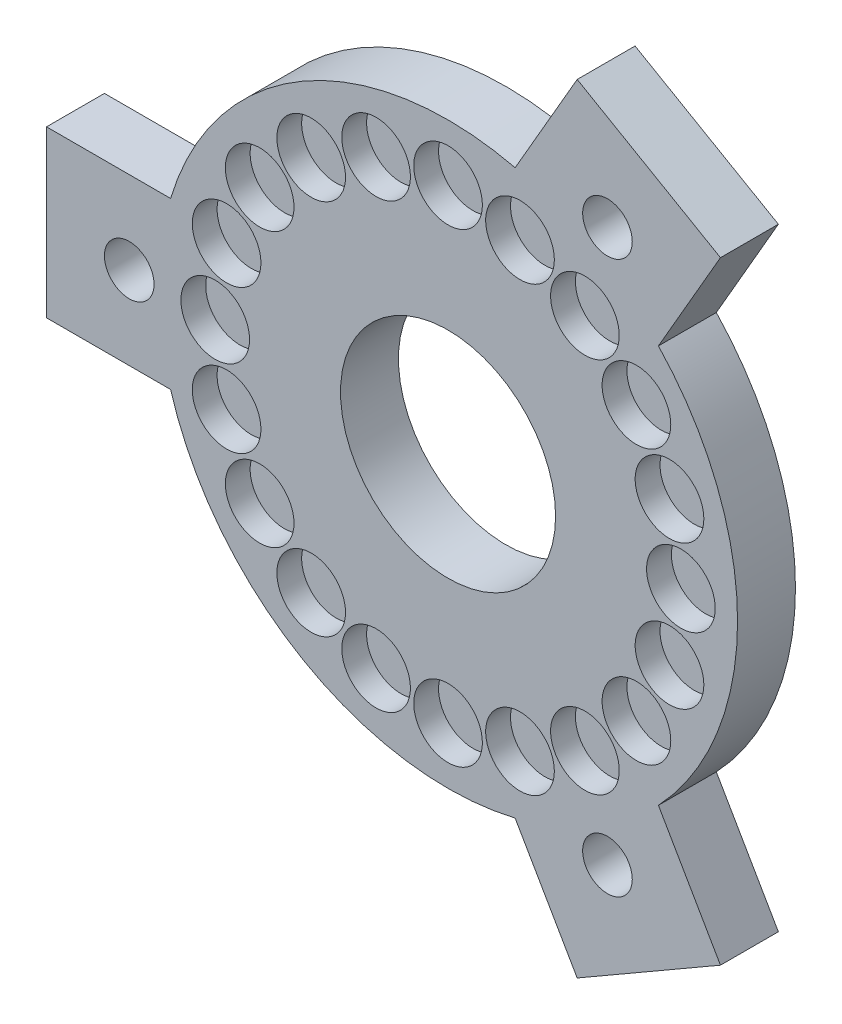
SolidWorks part; units mm, degrees
ref_plane "Ebene vorne" through (0, 0, 0) normal (0, 0, 1) x (1, 0, 0)
ref_plane "Ebene oben" through (0, 0, 0) normal (0, 1, 0) x (1, 0, 0)
ref_plane "Ebene rechts" through (0, 0, 0) normal (1, 0, 0) x (0, 0, -1)
sketch "Skizze1" plane through (0, 0, 0) normal (0, 0, 1) x (1, 0, 0)
  circle A0 centre (0, 0) radius 28.15
  circle A1 centre (0, 28.15) radius 4.3077
  circle A2 centre (8.6988, 26.7722) radius 4.3077
  circle A3 centre (16.5462, 22.7738) radius 4.3077
  circle A4 centre (22.7738, 16.5462) radius 4.3077
  circle A5 centre (26.7722, 8.6988) radius 4.3077
  circle A6 centre (28.15, 0) radius 4.3077
  circle A7 centre (26.7722, -8.6988) radius 4.3077
  circle A8 centre (22.7738, -16.5462) radius 4.3077
  circle A9 centre (16.5462, -22.7738) radius 4.3077
  circle A10 centre (8.6988, -26.7722) radius 4.3077
  circle A11 centre (0, -28.15) radius 4.3077
  circle A12 centre (-8.6988, -26.7722) radius 4.3077
  circle A13 centre (-16.5462, -22.7738) radius 4.3077
  circle A14 centre (-22.7738, -16.5462) radius 4.3077
  circle A15 centre (-26.7722, -8.6988) radius 4.3077
  circle A16 centre (-28.15, 0) radius 4.3077
  circle A17 centre (-26.7722, 8.6988) radius 4.3077
  circle A18 centre (-22.7738, 16.5462) radius 4.3077
  circle A19 centre (-16.5462, 22.7738) radius 4.3077
  circle A20 centre (-8.6988, 26.7722) radius 4.3077
  circle A21 centre (0, 0) radius 35
  point P46 (0, 0)
  dimension "D1" = 20
  dimension "D2" = 70
  dimension "D3" = 56.3
extrude "Aufsatz-Linear austragen3" add sketch "Skizze1" along normal blind 7 contours A21
sketch "Skizze3" plane through (0, 0, 7) normal (0, 0, 1) x (1, 0, 0)
  circle A0 centre (0, 0) radius 28.15
  circle A1 centre (0, 28.15) radius 4.15
  circle A2 centre (8.6988, 26.7722) radius 4.15
  circle A3 centre (16.5462, 22.7738) radius 4.15
  circle A4 centre (22.7738, 16.5462) radius 4.15
  circle A5 centre (26.7722, 8.6988) radius 4.15
  circle A6 centre (28.15, 0) radius 4.15
  circle A7 centre (26.7722, -8.6988) radius 4.15
  circle A8 centre (22.7738, -16.5462) radius 4.15
  circle A9 centre (16.5462, -22.7738) radius 4.15
  circle A10 centre (8.6988, -26.7722) radius 4.15
  circle A11 centre (0, -28.15) radius 4.15
  circle A12 centre (-8.6988, -26.7722) radius 4.15
  circle A13 centre (-16.5462, -22.7738) radius 4.15
  circle A14 centre (-22.7738, -16.5462) radius 4.15
  circle A15 centre (-26.7722, -8.6988) radius 4.15
  circle A16 centre (-28.15, 0) radius 4.15
  circle A17 centre (-26.7722, 8.6988) radius 4.15
  circle A18 centre (-22.7738, 16.5462) radius 4.15
  circle A19 centre (-16.5462, 22.7738) radius 4.15
  circle A20 centre (-8.6988, 26.7722) radius 4.15
  point P46 (0, 0)
  dimension "D1" = 20
  dimension "D2" = 56.3
  dimension "D3" = 8.3
extrude "Schnitt-Linear austragen1" cut sketch "Skizze3" against normal blind 3 contours A0 A8 | A0 A8 | A0 A3 | A0 A3 | A10 | A9 | A7 | A6 | A5 | A4 | A2 | A1 | A20 | A19 | A18 | A17 | A16 | A15 | A14 | A13 | A12 | A11
sketch "Skizze4" plane through (0, 0, 7) normal (0, 0, 1) x (1, 0, 0)
  circle A0 centre (0, 0) radius 13
  dimension "D1" = 26
extrude "Schnitt-Linear austragen2" cut sketch "Skizze4" against normal up to next
ref_plane "Ebene1" through (0, 0, 0) normal (0, 0, -1) x (-1, 0, 0)
sketch "Skizze6" plane through (0, 0, 0) normal (0, 0, -1) x (-1, 0, 0)
  line L0 (-15.6103, -47.0378) -> (-32.9308, -37.0378)
  line L5 (48.541, 10) -> (33.541, 10)
  line L6 (48.541, 10) -> (48.541, -10)
  line L7 (48.541, -10) -> (33.541, -10)
  line L8 (33.541, 10) -> (33.541, -10)
  line L9 (-15.6103, -47.0378) -> (-8.1103, -34.0474)
  line L10 (-8.1103, -34.0474) -> (-25.4308, -24.0474)
  line L11 (-32.9308, -37.0378) -> (-25.4308, -24.0474)
  line L12 (-32.9308, 37.0378) -> (-15.6103, 47.0378)
  line L13 (-32.9308, 37.0378) -> (-25.4308, 24.0474)
  line L14 (-25.4308, 24.0474) -> (-8.1103, 34.0474)
  line L15 (-15.6103, 47.0378) -> (-8.1103, 34.0474)
  circle A0 centre (0, 0) radius 35 construction
  point P18 (0, 0)
  dimension "D1" = 3
  dimension "D3" = 20
  dimension "D4" = 15
  dimension "D5" = 10
extrude "Aufsatz-Linear austragen4" add sketch "Skizze6" against normal blind 7
sketch "Skizze9" plane through (0, 0, 0) normal (0, 0, -1) x (-1, 0, 0)
  line L0 (48.541, -10) -> (48.541, 10) construction
  line L1 (-8.1103, 34.0474) -> (-15.6103, 47.0378) construction
  line L2 (-15.6103, 47.0378) -> (-32.9308, 37.0378) construction
  circle A0 centre (38.541, 0) radius 3
  circle A1 centre (-19.2705, -33.3775) radius 3
  circle A2 centre (-19.2705, 33.3775) radius 3
  point P11 (0, 0)
  dimension "D1" = 10
  dimension "D3" = 6
  dimension "D4" = 10
  dimension "D5" = 10
  dimension "D2" = 3
extrude "Schnitt-Linear austragen5" cut sketch "Skizze9" against normal up to next
